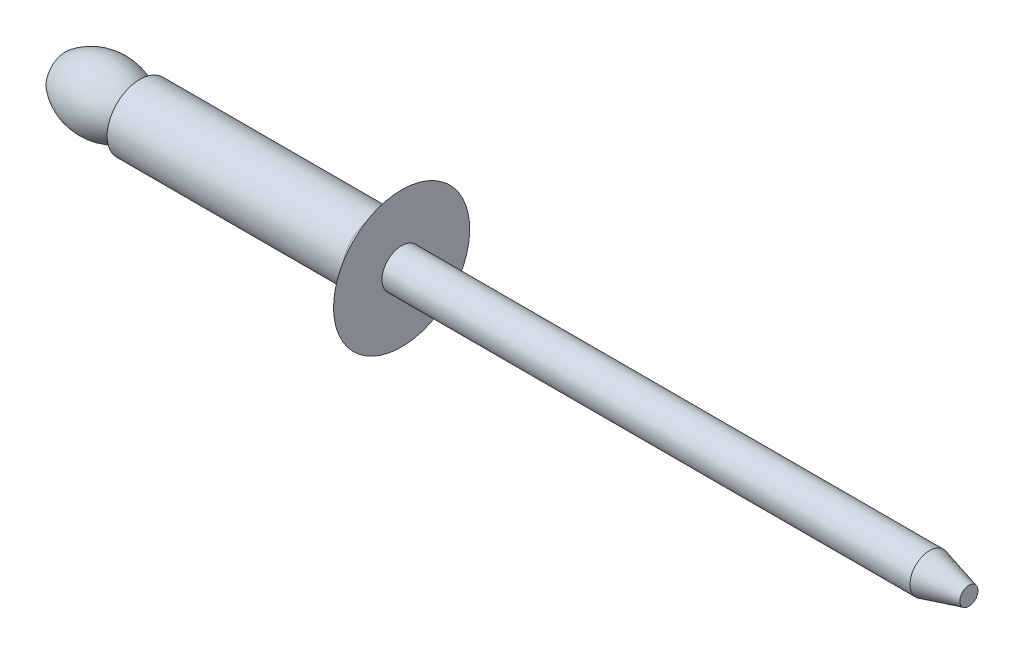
SolidWorks part; units mm, degrees
ref_plane "Front" through (0, 0, 0) normal (0, 0, 1) x (1, 0, 0)
ref_plane "Top" through (0, 0, 0) normal (0, 1, 0) x (1, 0, 0)
ref_plane "Right" through (0, 0, 0) normal (1, 0, 0) x (0, 0, -1)
sketch "Sketch1" plane through (-30.2384, 33.3584, 0) normal (0, 0, 1) x (0, -1, 0)
  line L0 (34.2584, 33.6384) -> (34.8584, 33.6384)
  line L1 (34.8584, 33.6384) -> (34.8584, 44.7031)
  line L2 (34.8584, 44.7031) -> (36.4784, 45.6384)
  line L3 (36.4784, 45.6384) -> (34.2584, 45.6384)
  line L4 (34.2584, 45.6384) -> (34.2584, 71.6384)
  line L5 (33.3584, 73.8835) -> (33.3584, -10.2868) construction
  line L6 (34.2584, 71.6384) -> (33.3584, 71.6384)
  line L7 (33.3584, 71.6384) -> (33.3584, 30.2384)
  line L8 (34.2584, 30.2384) -> (33.3584, 30.2384)
  arc A0 (34.2584, 33.6384) -> (34.2584, 30.2384) centre (32.15, 31.9384) cw
  dimension "l" = 12
  dimension "d" = 3
  dimension "D3" = 60
  dimension "dk" = 6.24
  dimension "d1" = 1.8
  dimension "l1" = 26
  dimension "l2" = 3.4
revolve "Base-Revolve" add sketch "Sketch1" angle 360 about L5
fillet "Fillet1" radius 0.5 1 edges at (14.4647, 1.5, 0)
chamfer "Chamfer1" distance 1.8 angle 15 1 edges at (41.4, 0.9, 0)
equation "\"D1@Chamfer1\" = \"d1@Sketch1\""
